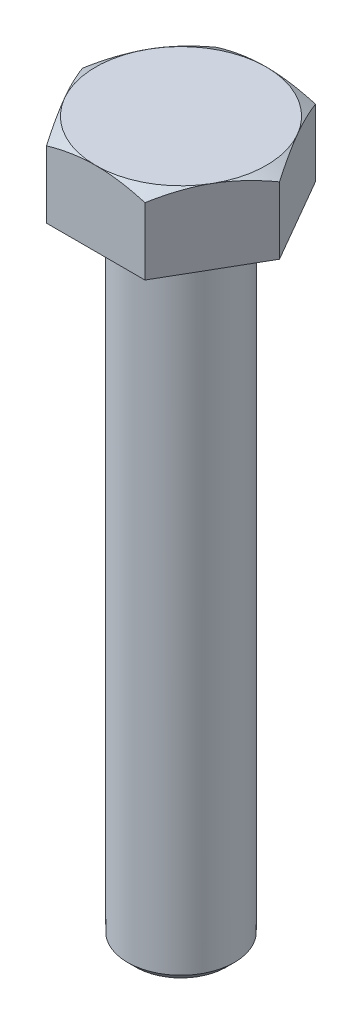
SolidWorks part; units mm, degrees
ref_plane "Front" through (0, 0, 0) normal (0, 0, 1) x (1, 0, 0)
ref_plane "Top" through (0, 0, 0) normal (0, 1, 0) x (1, 0, 0)
ref_plane "Right" through (0, 0, 0) normal (1, 0, 0) x (0, 0, -1)
sketch "Sketch1" plane through (0, 0, 0) normal (0, 1, 0) x (1, 0, 0)
  line L1 (9.2376, 0) -> (4.6188, 8)
  line L2 (4.6188, 8) -> (-4.6188, 8)
  line L3 (-4.6188, 8) -> (-9.2376, 0)
  line L4 (-9.2376, 0) -> (-4.6188, -8)
  line L5 (-4.6188, -8) -> (4.6188, -8)
  line L6 (4.6188, -8) -> (9.2376, 0)
  circle A0 centre (0, 0) radius 8 construction
  dimension "D1" = 16
extrude "Boss-Extrude1" add sketch "Sketch1" along normal blind 7
sketch "Sketch3" plane through (0, 0, 0) normal (0, -1, 0) x (1, 0, 0)
  circle A0 centre (0, 0) radius 5
  dimension "D1" = 10
extrude "Boss-Extrude2" add sketch "Sketch3" along normal blind 60
sketch "Sketch2" plane through (0, 7, 0) normal (0, 1, 0) x (1, 0, 0)
  line L0 (4.6188, -8) -> (9.2376, 0) construction
  circle A0 centre (0, 0) radius 8
extrude "Cut-Extrude1" cut sketch "Sketch2" against normal blind 7 draft 60 flip side to cut
sketch "Sketch4" plane through (0, -60, 0) normal (0, -1, 0) x (1, 0, 0)
  circle A0 centre (0, 0) radius 4.25
  dimension "D1" = 8.5
extrude "Cut-Extrude2" cut sketch "Sketch4" against normal blind 10 draft 45 flip side to cut
